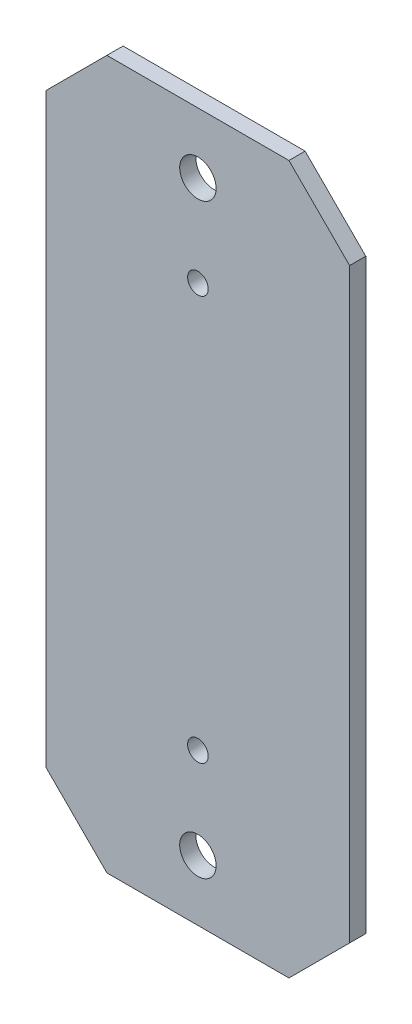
SolidWorks part; units mm, degrees
ref_plane "Plan de face" through (0, 0, 0) normal (0, 0, 1) x (1, 0, 0)
ref_plane "Plan de dessus" through (0, 0, 0) normal (0, 1, 0) x (1, 0, 0)
ref_plane "Plan de droite" through (0, 0, 0) normal (1, 0, 0) x (0, 0, -1)
sketch "Esquisse1" plane through (0, 0, 0) normal (0, 0, 1) x (1, 0, 0)
  line L0 (75, 175) -> (-75, -175)
  line L1 (75, 175) -> (75, -175)
  line L2 (75, 175) -> (-75, 175)
  line L3 (-75, 175) -> (-75, -175)
  line L4 (75, -175) -> (-75, -175)
  line L5 (-75, 175) -> (75, -175)
  line L6 (75, 0) -> (-75, 0)
  line L7 (0, 175) -> (0, -175)
  circle A0 centre (0, 145) radius 9
  circle A1 centre (0, -145) radius 9
  dimension "D4" = 18
  dimension "D1" = 350
  dimension "D2" = 150
  dimension "D3" = 30
extrude "Extrusion1" add sketch "Esquisse1" along normal blind 8 contours L7 A0 L0 L2 | L7 A0 L2 L5 | L6 L5 L3 | L0 L6 L3 | A1 L7 L0 L4 | A1 L7 L4 L5 | L1 L6 L5 | L6 L1 L0
chamfer "Chanfrein1" distance 30 angle 45 4 edges at (75, 175, 4) (-75, 175, 4) (-75, -175, 4) (75, -175, 4)
hole_wizard "Trou taraudé M121" positions "Esquisse3D1" profile "Esquisse2" tap size "M12" standard "ISO"
sketch3d "Esquisse3D1"
  line L0 (75, 0, 0) -> (-75, 0, 0) construction
  line L1 (75, 145, 0) -> (75, -145, 0) construction
  line L2 (-75, 145, 0) -> (-75, -145, 0) construction
  line L4 (0, -175, 0) -> (0, 175, 0) construction
  line L5 (45, -175, 0) -> (-45, -175, 0) construction
  line L6 (45, 175, 0) -> (-45, 175, 0) construction
  point P0 (0, -100, 0)
  point P2 (0, 100, 0)
  dimension "D1" = 100
  dimension "D2" = 100
sketch "Esquisse2" plane through (0, -100, 0) normal (1, 0, 0) x (0, 1, 0)
  line L0 (0, 0) -> (0, 32.3144)
  line L1 (0, 32.3144) -> (5.1, 29.25)
  line L2 (5.1, 29.25) -> (5.1, 0)
  line L5 (5.1, 0) -> (0, 0)
  line L10 (0, 32.3144) -> (-5.1, 29.25) construction
  line L11 (0, -6.35) -> (0, 107.95) construction
  dimension "Diamètre du trou pour taraudage" = 10.2
  dimension "Profondeur du trou pour taraudage" = 29.25
  dimension "Angle de pointe" = 118
